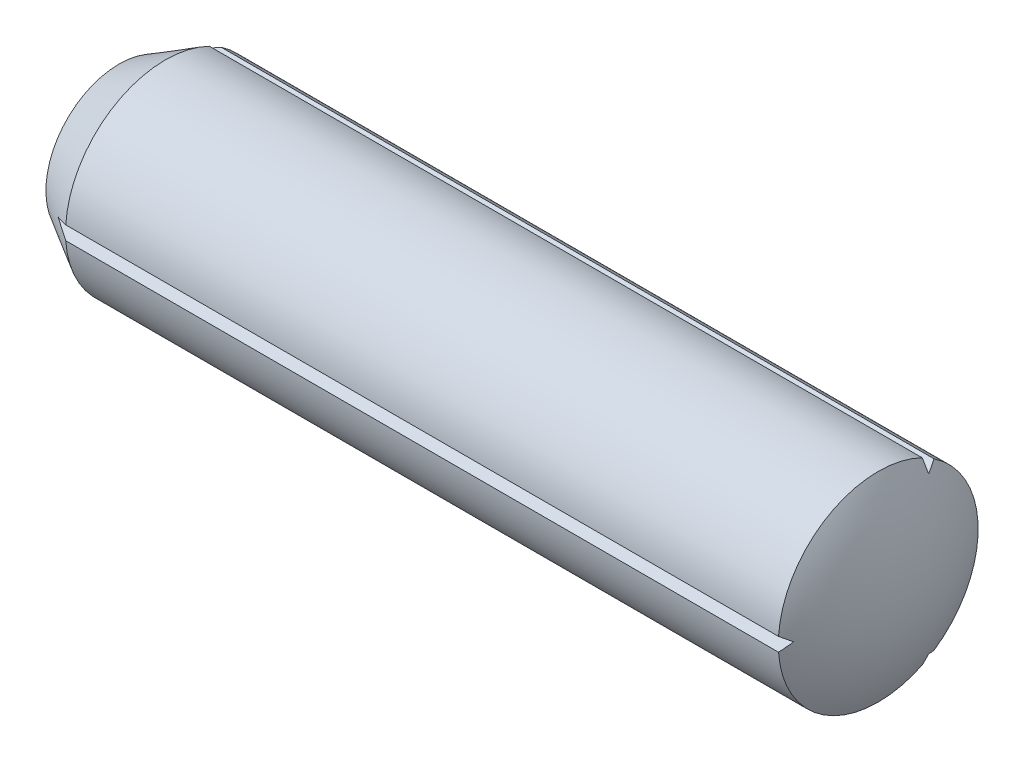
SolidWorks part; units mm, degrees
ref_plane "Plane1" through (0, 0, 0) normal (0, 0, 1) x (1, 0, 0)
ref_plane "Plane2" through (0, 0, 0) normal (0, 1, 0) x (1, 0, 0)
ref_plane "Plane3" through (0, 0, 0) normal (1, 0, 0) x (0, 0, -1)
sketch "Sketch1" plane through (0, 0, 0) normal (0, 0, 1) x (1, 0, 0)
  line L0 (-117, 0) -> (21, 0) construction
  line L1 (-92.5, 12.5) -> (-98.295, 9.1543)
  line L2 (-92.5, 12.5) -> (-3.3494, 12.5)
  line L3 (-100, 0) -> (0, 0)
  line L4 (-100, 0) -> (-100, 1.25)
  arc A0 (-98.295, 9.1543) -> (-100, 1.25) centre (-75.0313, 0) ccw
  arc A1 (0, 0) -> (-3.3494, 12.5) centre (-25, 0) ccw
  dimension "D1" = 2.5
  dimension "D2" = 25
  dimension "D4" = 25
  dimension "Diameter" = 25
  dimension "D3" = 30
  dimension "Length" = 100
  dimension "Chamfer2" = 7.5
revolve "Base-Revolve" add sketch "Sketch1" angle 360 about L0
sketch "Sketch2" plane through (0, 0, 0) normal (1, 0, 0) x (0, 0, -1)
  line L0 (0, 0) -> (-14, 0) construction
  line L1 (-11.25, 0) -> (-12.5, 0.8753)
  line L2 (-11.25, 0) -> (-12.5, -0.8753)
  line L3 (-12.5, -0.8753) -> (-12.5, 0.8753)
  circle A0 centre (0, 0) radius 11.25 construction
  circle A1 centre (0, 0) radius 12.5 construction
  dimension "D1" = 22.5
  dimension "D2" = 70
  dimension "D3" = 35
extrude "Cut-Extrude1" cut sketch "Sketch2" against normal through all
pattern_circular "CirPattern2" count 3 over 360 about axis through (0, 0, 0) along (1, 0, 0) of "Cut-Extrude1"
equation "\"D2@Sketch1\" = \"Diameter@Sketch1\""
equation "\"D1@Sketch2\" = \"Diameter@Sketch1\" * .9"
equation "\"D3@Sketch2\" = \"D2@Sketch2\" / 2"
equation "\"D1@Sketch1\" = \"Diameter@Sketch1\" * .1"
equation "\"D4@Sketch1\" = \"Diameter@Sketch1\""
